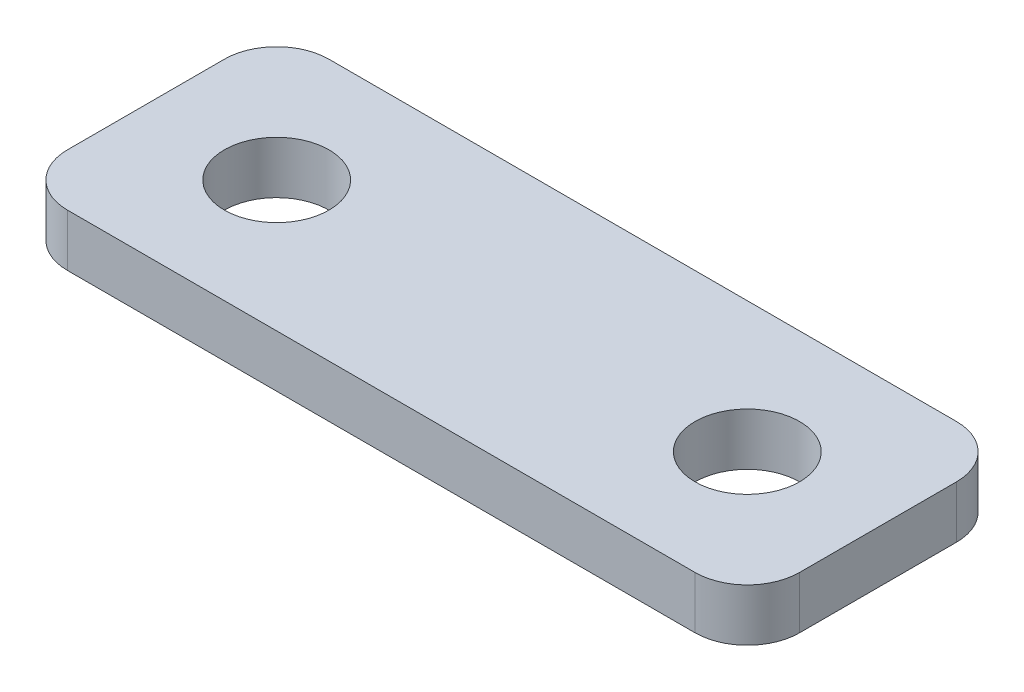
SolidWorks part; units mm, degrees
ref_plane "Front Plane" through (0, 0, 0) normal (0, 0, 1) x (1, 0, 0)
ref_plane "Top Plane" through (0, 0, 0) normal (0, 1, 0) x (1, 0, 0)
ref_plane "Right Plane" through (0, 0, 0) normal (1, 0, 0) x (0, 0, -1)
sketch "Sketch1" plane through (0, 0, 0) normal (0, 1, 0) x (1, 0, 0)
  line L0 (-14.2875, 0) -> (14.2875, 0) construction
  line L1 (-19.05, 7.9375) -> (19.05, 7.9375)
  line L2 (-22.225, 4.7625) -> (-22.225, -4.7625)
  line L3 (-19.05, -7.9375) -> (19.05, -7.9375)
  line L4 (22.225, 4.7625) -> (22.225, -4.7625)
  line L5 (-22.225, 7.9375) -> (22.225, -7.9375) construction
  line L6 (-22.225, -7.9375) -> (22.225, 7.9375) construction
  circle A0 centre (-14.2875, 0) radius 3.175
  circle A1 centre (14.2875, 0) radius 3.175
  arc A2 (-22.225, -4.7625) -> (-19.05, -7.9375) centre (-19.05, -4.7625) ccw
  arc A3 (19.05, -7.9375) -> (22.225, -4.7625) centre (19.05, -4.7625) ccw
  arc A4 (19.05, 7.9375) -> (22.225, 4.7625) centre (19.05, 4.7625) cw
  arc A5 (-19.05, 7.9375) -> (-22.225, 4.7625) centre (-19.05, 4.7625) ccw
  point P0 (0, 0)
  point P9 (0, 0)
  dimension "D2" = 6.35
  dimension "D5" = 3.175
  dimension "D1" = 28.575
  dimension "D3" = 44.45
  dimension "D4" = 15.875
extrude "Boss-Extrude1" add sketch "Sketch1" along normal blind 3.175
